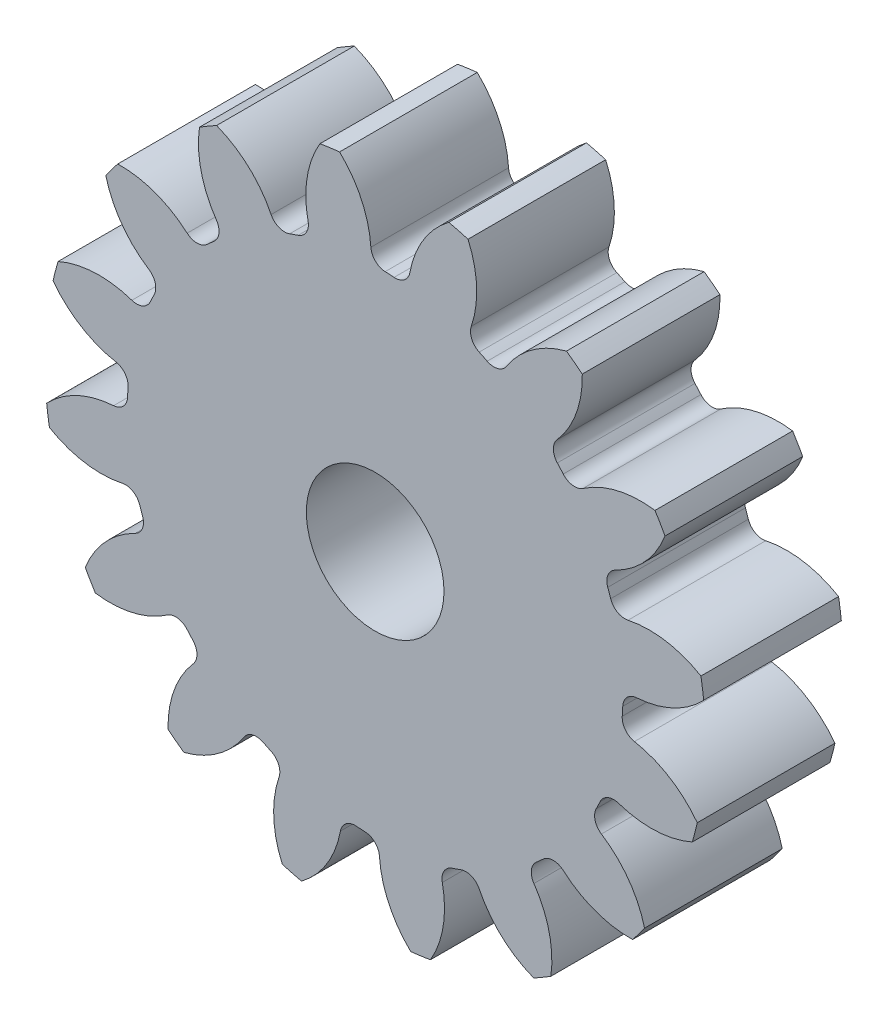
SolidWorks part; units mm, degrees
ref_plane "Front" through (0, 0, 0) normal (0, 0, 1) x (1, 0, 0)
ref_plane "Top" through (0, 0, 0) normal (0, 1, 0) x (1, 0, 0)
ref_plane "Right" through (0, 0, 0) normal (1, 0, 0) x (0, 0, -1)
sketch "Sketch3" plane through (0, 0, 0) normal (0, 0, 1) x (1, 0, 0)
  circle A0 centre (0, 0) radius 304.8
  dimension "od" = 609.6
extrude "gearBody" add sketch "Sketch3" along normal blind 127
sketch "Sketch2" plane through (0, 0, 0) normal (0, 0, 1) x (1, 0, 0)
  line L0 (0, 0) -> (235.2142, 97.4289) construction
  line L1 (298.6748, -70.0149) -> (0, 0) construction
  line L2 (0, 0) -> (36.3143, 0) construction
  line L3 (270.7201, 10.748) -> (267.6218, -42.2311) construction
  line L5 (269.1709, -15.7415) -> (0, 0) construction
  line L7 (0, 0) -> (254.5941, 0) construction
  arc A0 (254.5286, 5.7709) -> (252.1209, -35.4005) centre (0, 0) ccw construction
  arc A1 (303.0288, 32.8114) -> (297.1384, -67.9101) centre (0, 0) ccw construction
  arc A2 (270.7201, 10.748) -> (267.6218, -42.2311) centre (0, 0) ccw construction
  arc A3 (227.9333, -17.4458) -> (228.4131, -9.2421) centre (0, 0) ccw
  arc A4 (298.6748, -70.0149) -> (239.1854, -32.0544) centre (222.2541, -124.1824) ccw
  arc A5 (298.6748, -70.0149) -> (304.8, 34.7228) centre (0, 0) ccw
  arc A6 (304.8, 34.7228) -> (241.2913, 3.9554) centre (235.2142, 97.4289) cw
  arc A7 (228.4131, -9.2421) -> (241.2913, 3.9554) centre (242.1856, -9.7993) cw
  arc A8 (239.1854, -32.0544) -> (227.9333, -17.4458) centre (241.6769, -18.4977) cw
  point P6 (304.8, 34.7228)
  point P22 (298.6748, -70.0149)
  dimension "baseDia" = 509.1881
  dimension "od" = 609.6
  dimension "pd" = 541.8667
  dimension "rd" = 457.2
  dimension "rFillet" = 13.7837
  dimension "pointX" = 304.8
  dimension "pointY" = 34.7228
  dimension "CTT" = 52.9791
  dimension "flankCenterAngle" = 22.5
extrude "toothCut" cut sketch "Sketch2" along normal through all
pattern_circular "CirPattern1" count 16 over 360 about axis through (0, 0, 0) along (0, 0, 1) of "toothCut"
sketch "hub1Dia" plane through (0, 0, 0) normal (0, 0, -1) x (-1, 0, 0)
  circle A0 centre (0, 0) radius 12.7
  dimension "hub1Dia" = 25.4
sketch "hub2Dia" plane through (0, 0, 127) normal (0, 0, 1) x (1, 0, 0)
  circle A0 centre (0, 0) radius 12.7
  dimension "hub2dia" = 25.4
sketch "boreDia" plane through (0, 0, 0) normal (0, 0, 1) x (1, 0, 0)
  circle A0 centre (0, 0) radius 63.5
  dimension "boreDia" = 127
extrude "bore" cut sketch "boreDia" against normal mid plane 25400
